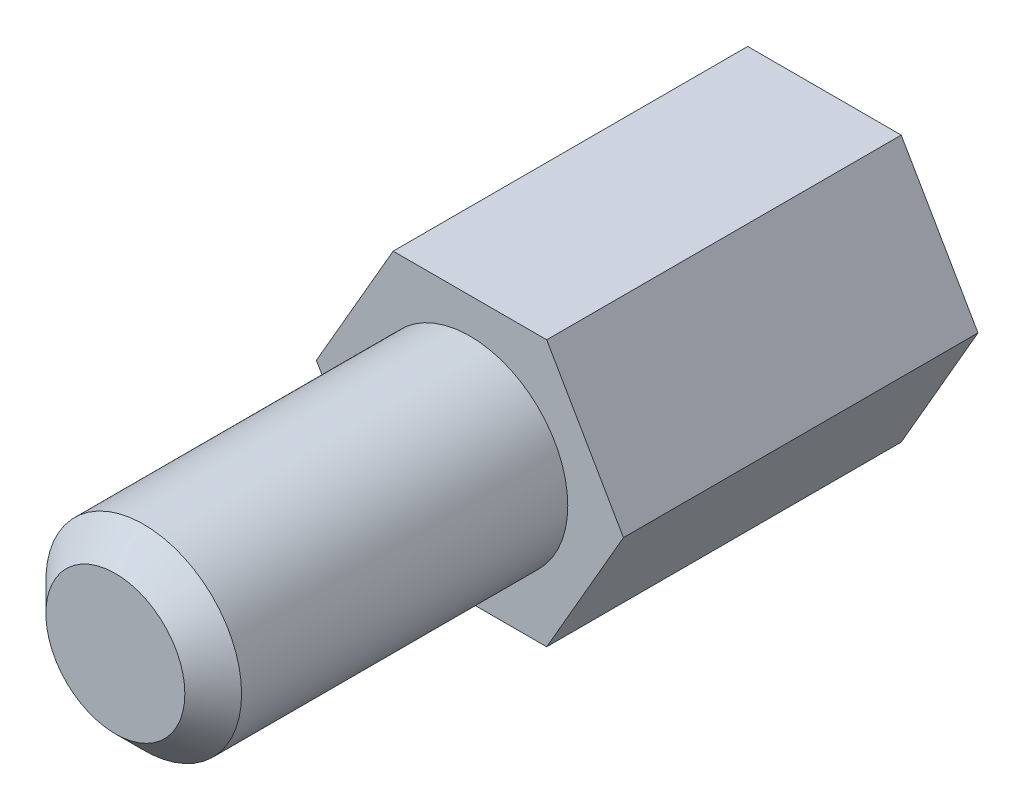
SolidWorks part; units mm, degrees
ref_plane "Plane1" through (0, 0, 0) normal (0, 0, 1) x (1, 0, 0)
ref_plane "Plane2" through (0, 0, 0) normal (0, 1, 0) x (1, 0, 0)
ref_plane "Plane3" through (0, 0, 0) normal (1, 0, 0) x (0, 0, -1)
sketch "Sketch1" plane through (0, 0, 0) normal (0, 0, 1) x (1, 0, 0)
  circle A0 centre (0, 0) radius 1.7526
  dimension "D1" = 3.5052
extrude "Base-Extrude" add sketch "Sketch1" along normal blind 6.35
sketch "Hexagon - circumscribed1" plane through (0.3433, 0.2639, 0) normal (0, 0, -1) x (-1, 0, 0)
  line L0 (-1.0315, 2.1174) -> (1.7181, 2.1174)
  line L1 (1.7181, 2.1174) -> (3.093, -0.2639)
  line L2 (3.093, -0.2639) -> (1.7181, -2.6451)
  line L3 (1.7181, -2.6451) -> (-1.0315, -2.6451)
  line L4 (-1.0315, -2.6451) -> (-2.4063, -0.2639)
  line L5 (-2.4063, -0.2639) -> (-1.0315, 2.1174)
  circle A0 centre (0.3433, -0.2639) radius 2.3813 construction
  dimension "D1" = 4.7625
extrude "Boss-Extrude1" add sketch "Hexagon - circumscribed1" along normal blind 6.35
chamfer "Chamfer1" distance 0.508 angle 45
sketch "Sketch3" plane through (0, 0, -6.35) normal (0, 0, -1) x (-1, 0, 0)
  circle A0 centre (0, 0) radius 1.3208
  dimension "D1" = 2.6416
extrude "Cut-Extrude1" cut sketch "Sketch3" against normal blind 3.9624
